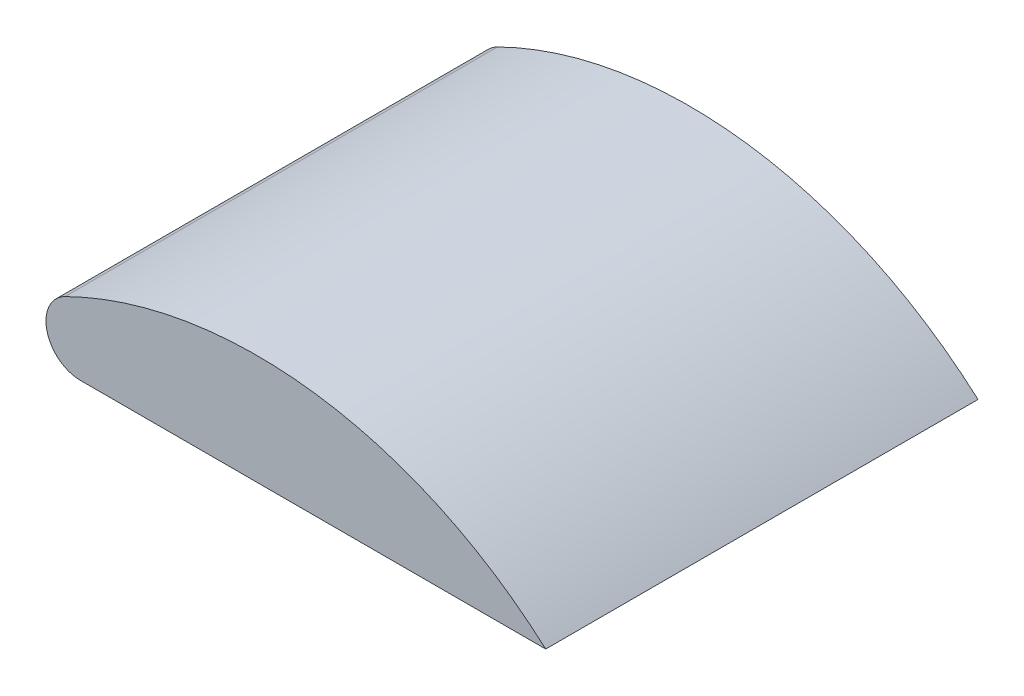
SolidWorks part; units mm, degrees
ref_plane "Ebene vorne" through (0, 0, 0) normal (0, 0, 1) x (1, 0, 0)
ref_plane "Ebene oben" through (0, 0, 0) normal (0, 1, 0) x (1, 0, 0)
ref_plane "Ebene rechts" through (0, 0, 0) normal (1, 0, 0) x (0, 0, -1)
sketch "Skizze1" plane through (0, 0, 0) normal (0, 0, 1) x (1, 0, 0)
  line L0 (0, 0) -> (107.6715, 0)
  arc A0 (-3.5117, 15.0288) -> (107.6715, 0) centre (40.9402, -74.8974) cw
  arc A1 (0, 0) -> (-3.5117, 15.0288) centre (0, 7.9247) cw
surface "Oberfläche-Linear austragen1" sketch "Skizze1" parameters "D1"=100
ref_plane "Ebene1" through (0, 0, 50) normal (0, 0, 1) x (1, 0, 0)
ref_plane "Ebene2" through (0, 0, -50) normal (0, 0, 1) x (1, 0, 0)
sketch "Skizze2" plane through (0, 0, 50) normal (0, 0, 1) x (1, 0, 0)
  line L0 (107.6715, 0) -> (0, 0) construction
  line L1 (107.6715, 0) -> (0, 0)
  arc A0 (-3.5117, 15.0288) -> (0, 0) centre (0, 7.9247) ccw construction
  arc A1 (107.6715, 0) -> (-3.5117, 15.0288) centre (40.9402, -74.8974) ccw construction
  arc A2 (-3.5117, 15.0288) -> (0, 0) centre (0, 7.9247) ccw
  arc A3 (107.6715, 0) -> (-3.5117, 15.0288) centre (40.9402, -74.8974) ccw
surface "Oberfläche-Ebene2" sketch "Skizze2"
sketch "Skizze3" plane through (0, 0, -50) normal (0, 0, 1) x (1, 0, 0)
  line L0 (0, 0) -> (107.6715, 0) construction
  line L1 (0, 0) -> (107.6715, 0)
  arc A0 (-3.5117, 15.0288) -> (0, 0) centre (0, 7.9247) ccw construction
  arc A1 (107.6715, 0) -> (-3.5117, 15.0288) centre (40.9402, -74.8974) ccw construction
  arc A2 (-3.5117, 15.0288) -> (0, 0) centre (0, 7.9247) ccw
  arc A3 (107.6715, 0) -> (-3.5117, 15.0288) centre (40.9402, -74.8974) ccw
surface "Oberfläche-Ebene3" sketch "Skizze3"
surface "Oberfläche-Zusammenfügen1"
